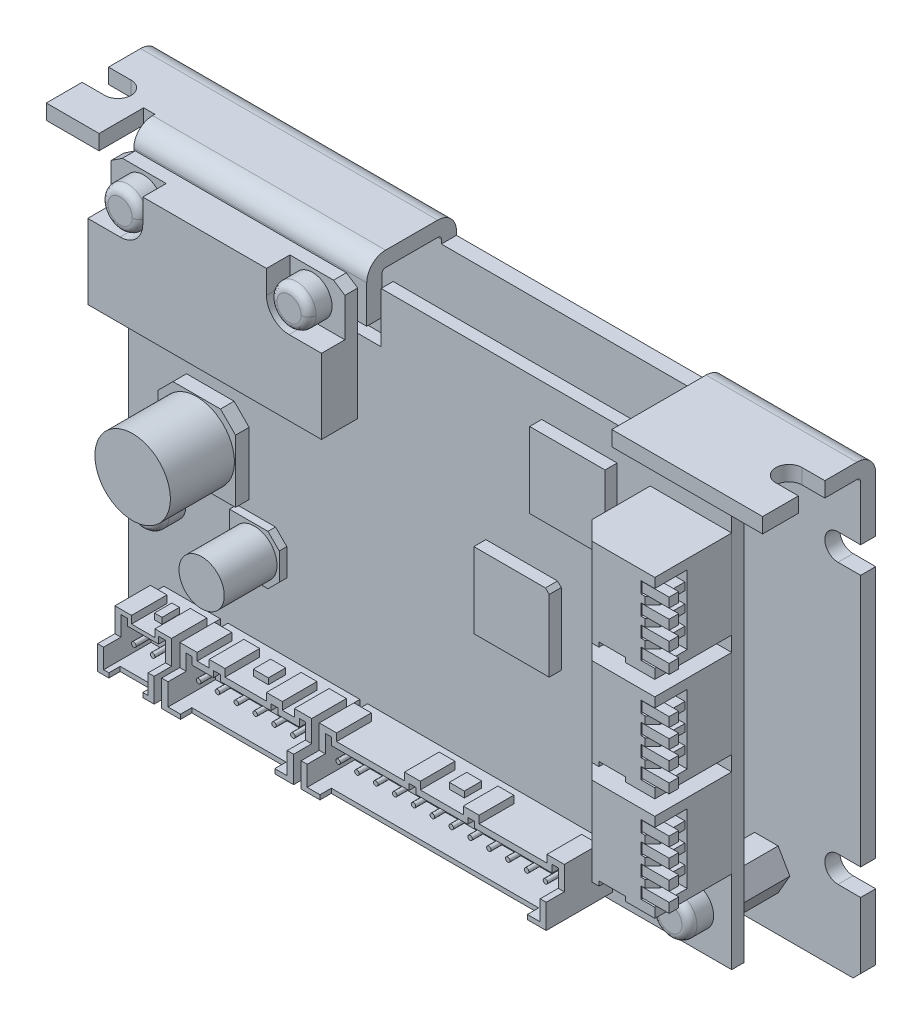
SolidWorks part; units mm, degrees
ref_plane "Front" through (0, 0, 0) normal (0, 0, 1) x (1, 0, 0)
ref_plane "Top" through (0, 0, 0) normal (0, 1, 0) x (1, 0, 0)
ref_plane "Right" through (0, 0, 0) normal (1, 0, 0) x (0, 0, -1)
ref_plane "Plane1" through (0, 0, 0) normal (0, 0, -1) x (-1, 0, 0)
sketch "Sketch1" plane through (0, 0, 0) normal (0, 0, -1) x (-1, 0, 0)
  line L0 (-47.5, -30) -> (-27.5, -30)
  line L1 (-27.5, -30) -> (-27.5, 30)
  line L2 (-27.5, 30) -> (-47.5, 30)
  line L3 (-47.5, 30) -> (-47.5, -30)
extrude "Extrude1" add sketch "Sketch1" against normal blind 15
sketch "Sketch2" plane through (47.5, 0, 0) normal (1, 0, 0) x (0, 0, -1)
  line L0 (-15, -30) -> (-2, -30)
  line L1 (-2, -30) -> (-2, 28)
  line L2 (-2, 28) -> (-15, 28)
  line L3 (-15, 28) -> (-15, -30)
extrude "Extrude2" cut sketch "Sketch2" against normal through all
sketch "Sketch3" plane through (27.5, 0, 0) normal (-1, 0, 0) x (0, 0, 1)
  line L0 (2, 27) -> (2, -30)
  line L1 (2, -30) -> (0, -30)
  line L2 (0, -30) -> (0, 27)
  line L3 (0, 27) -> (2, 27)
extrude "Extrude3" add sketch "Sketch3" along normal blind 75
sketch "Sketch4" plane through (0, 27, 0) normal (0, 1, 0) x (-1, 0, 0)
  line L0 (47.5, 2) -> (47.5, 0)
  line L1 (47.5, 0) -> (8.1, 0)
  line L2 (8.1, 0) -> (8.1, 2)
  line L3 (8.1, 2) -> (47.5, 2)
extrude "Extrude4" add sketch "Sketch4" along normal blind 3
sketch "Sketch5" plane through (0, 0, 2) normal (0, 0, 1) x (1, 0, 0)
  line L0 (-47.5, 28) -> (-47.5, 30)
  line L1 (-47.5, 30) -> (-8.1, 30)
  line L2 (-8.1, 30) -> (-8.1, 28)
  line L3 (-8.1, 28) -> (-47.5, 28)
extrude "Extrude5" add sketch "Sketch5" along normal blind 13
sketch "Sketch6" plane through (0, 30, 0) normal (0, 1, 0) x (-1, 0, 0)
  line L0 (8.1, 9.1) -> (40.5, 9.1)
  line L1 (40.5, 9.1) -> (40.5, 15)
  line L2 (40.5, 15) -> (8.1, 15)
  line L3 (8.1, 15) -> (8.1, 9.1)
extrude "Extrude6" cut sketch "Sketch6" against normal through all
sketch "Sketch7" plane through (0, 0, 9.1) normal (0, 0, 1) x (1, 0, 0)
  line L0 (-39, 28) -> (-39, 30)
  line L1 (-39, 30) -> (-8.1, 30)
  line L2 (-8.1, 30) -> (-8.1, 28)
  line L3 (-8.1, 28) -> (-39, 28)
extrude "Extrude7" add sketch "Sketch7" along normal blind 2.8
sketch "Sketch8" plane through (0, 28, 0) normal (0, -1, 0) x (1, 0, 0)
  line L0 (-39, 9.9) -> (-39, 11.9)
  line L1 (-39, 11.9) -> (-8.1, 11.9)
  line L2 (-8.1, 11.9) -> (-8.1, 9.9)
  line L3 (-8.1, 9.9) -> (-39, 9.9)
extrude "Extrude8" add sketch "Sketch8" along normal blind 5.5
sketch "Sketch9" plane through (0, 0, 0) normal (0, 0, -1) x (-1, 0, 0)
  line L0 (-47.5, -16.75) -> (-47.5, -20.25)
  line L1 (-47.5, -20.25) -> (-44.5, -20.25)
  line L2 (-44.5, -16.75) -> (-47.5, -16.75)
  arc A0 (-44.5, -20.25) -> (-44.5, -16.75) centre (-44.5, -18.5) ccw
extrude "Extrude9" cut sketch "Sketch9" against normal through all
sketch "Sketch10" plane through (0, 0, 0) normal (0, 0, -1) x (-1, 0, 0)
  line L0 (-47.5, 20.25) -> (-47.5, 16.75)
  line L1 (-47.5, 16.75) -> (-44.5, 16.75)
  line L2 (-44.5, 20.25) -> (-47.5, 20.25)
  arc A0 (-44.5, 16.75) -> (-44.5, 20.25) centre (-44.5, 18.5) ccw
extrude "Extrude10" cut sketch "Sketch10" against normal through all
sketch "Sketch11" plane through (0, 0, 0) normal (0, 0, -1) x (-1, 0, 0)
  line L0 (47.5, 16.75) -> (47.5, 20.25)
  line L1 (47.5, 20.25) -> (44.5, 20.25)
  line L2 (44.5, 16.75) -> (47.5, 16.75)
  arc A0 (44.5, 20.25) -> (44.5, 16.75) centre (44.5, 18.5) ccw
extrude "Extrude11" cut sketch "Sketch11" against normal through all
sketch "Sketch12" plane through (0, 28, 0) normal (0, -1, 0) x (1, 0, 0)
  line L0 (47.5, 10.25) -> (44.5, 10.25)
  line L1 (44.5, 6.75) -> (47.5, 6.75)
  line L2 (47.5, 6.75) -> (47.5, 10.25)
  arc A0 (44.5, 10.25) -> (44.5, 6.75) centre (44.5, 8.5) ccw
extrude "Extrude12" cut sketch "Sketch12" against normal through all
sketch "Sketch13" plane through (0, 0, 0) normal (0, 0, -1) x (-1, 0, 0)
  line L0 (47.5, -20.25) -> (47.5, -16.75)
  line L1 (47.5, -16.75) -> (44.5, -16.75)
  line L2 (44.5, -20.25) -> (47.5, -20.25)
  arc A0 (44.5, -16.75) -> (44.5, -20.25) centre (44.5, -18.5) ccw
extrude "Extrude13" cut sketch "Sketch13" against normal through all
sketch "Sketch14" plane through (0, 28, 0) normal (0, -1, 0) x (1, 0, 0)
  line L0 (-47.5, 6.75) -> (-44.5, 6.75)
  line L1 (-44.5, 10.25) -> (-47.5, 10.25)
  line L2 (-47.5, 10.25) -> (-47.5, 6.75)
  arc A0 (-44.5, 6.75) -> (-44.5, 10.25) centre (-44.5, 8.5) ccw
extrude "Extrude14" cut sketch "Sketch14" against normal through all
sketch "Sketch15" plane through (0, 0, 2) normal (0, 0, 1) x (1, 0, 0)
  line L0 (38.1177, -22.5) -> (36.5588, -25.2)
  line L1 (36.5588, -25.2) -> (33.4412, -25.2)
  line L2 (33.4412, -25.2) -> (31.8823, -22.5)
  line L3 (31.8823, -22.5) -> (33.4412, -19.8)
  line L4 (33.4412, -19.8) -> (36.5588, -19.8)
  line L5 (36.5588, -19.8) -> (38.1177, -22.5)
extrude "Extrude15" add sketch "Sketch15" along normal blind 8
sketch "Sketch16" plane through (0, 0, 2) normal (0, 0, 1) x (1, 0, 0)
  line L0 (-33.2412, -7.8) -> (-31.6823, -10.5)
  line L1 (-31.6823, -10.5) -> (-33.2412, -13.2)
  line L2 (-33.2412, -13.2) -> (-36.3588, -13.2)
  line L3 (-36.3588, -13.2) -> (-37.9177, -10.5)
  line L4 (-37.9177, -10.5) -> (-36.3588, -7.8)
  line L5 (-36.3588, -7.8) -> (-33.2412, -7.8)
extrude "Extrude16" add sketch "Sketch16" along normal blind 8
hole_wizard "HoleWzd1" positions "Sketch18" profile "Sketch17" hole size "Ø2.4" standard "Ansi Metric"
sketch "Sketch18" plane through (0, 0, 9.9) normal (0, 0, -1) x (-1, 0, 0)
  point P0 (36, 24.2)
sketch "Sketch17" plane through (-36, 24.2, 9.9) normal (1, 0, 0) x (0, 1, 0)
  line L0 (0, 0) -> (0, 5.1)
  line L1 (0, 5.1) -> (1.2, 5.1)
  line L2 (1.2, 5.1) -> (1.2, 0)
  line L5 (1.2, 0) -> (0, 0)
  line L11 (0, -6.35) -> (0, 107.95) construction
  dimension "通し穴の直径" = 2.4
  dimension "通し穴の深さ" = 5.1
hole_wizard "HoleWzd2" positions "Sketch20" profile "Sketch19" hole size "Ø2.4" standard "Ansi Metric"
sketch "Sketch20" plane through (0, 0, 11.9) normal (0, 0, 1) x (1, 0, 0)
  point P0 (-11.6, 24.2)
sketch "Sketch19" plane through (-11.6, 24.2, 11.9) normal (1, 0, 0) x (0, -1, 0)
  line L0 (0, 0) -> (0, 2)
  line L1 (0, 2) -> (1.2, 2)
  line L2 (1.2, 2) -> (1.2, 0)
  line L5 (1.2, 0) -> (0, 0)
  line L11 (0, -6.35) -> (0, 107.95) construction
  dimension "通し穴の直径" = 2.4
  dimension "通し穴の深さ" = 2
chamfer "Chamfer1" distance 1 angle 45
fillet "Fillet1" radius 0.5
fillet "Fillet2" radius 2.5
imported_body "Imported3"
imported_body "Imported4"
imported_body "Imported5"
imported_body "Imported6"
imported_body "Imported7"
imported_body "Imported8"
imported_body "Imported9"
imported_body "Imported10"
sketch "Sketch21" plane through (0, 0, 0) normal (0, 0, -1) x (-1, 0, 0)
  line L0 (-9.7429, -44.5588) -> (10.2571, -44.5588)
  line L1 (10.2571, -44.5588) -> (10.2571, 15.4412)
  line L2 (10.2571, 15.4412) -> (-9.7429, 15.4412)
  line L3 (-9.7429, 15.4412) -> (-9.7429, -44.5588)
